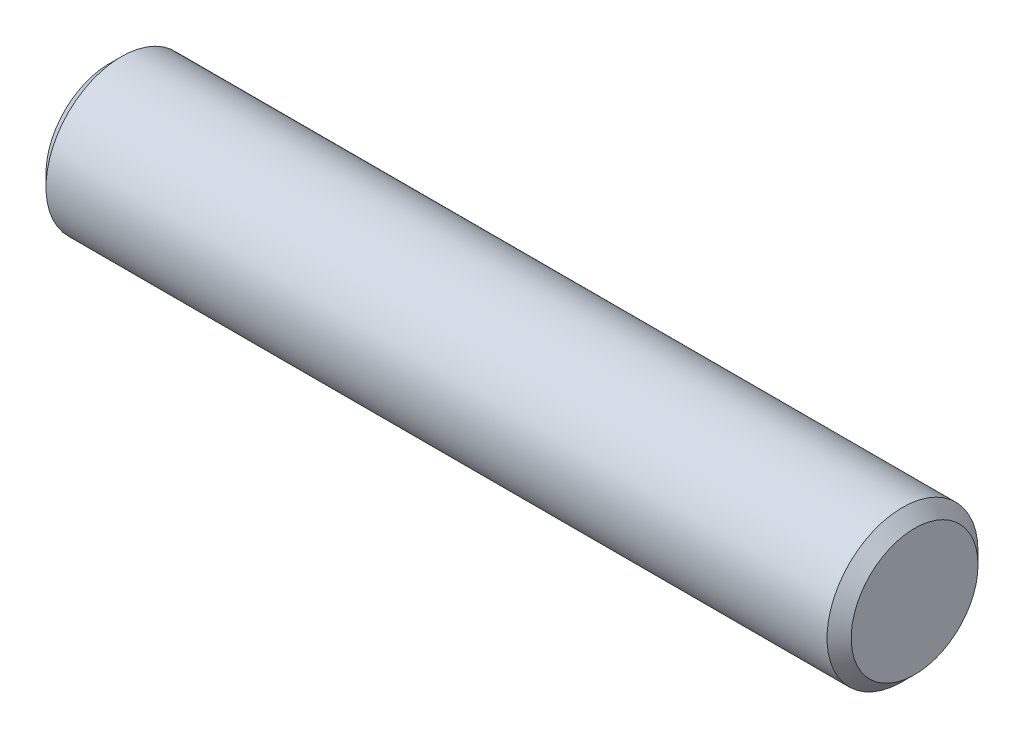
SolidWorks part; units mm, degrees
ref_plane "Front" through (0, 0, 0) normal (0, 0, 1) x (1, 0, 0)
ref_plane "Top" through (0, 0, 0) normal (0, 1, 0) x (1, 0, 0)
ref_plane "Right" through (0, 0, 0) normal (1, 0, 0) x (0, 0, -1)
sketch "Sketch1" plane through (0, 0, 0) normal (1, 0, 0) x (0, 0, -1)
  circle A0 centre (0, 0) radius 2.3812
  dimension "D1" = 4.7625
extrude "Extrude1" add sketch "Sketch1" along normal blind 25.4
chamfer "Chamfer1" distance 0.381 angle 45 2 edges at (0, 0, -2.3812) (25.4, 0, -2.3812)
